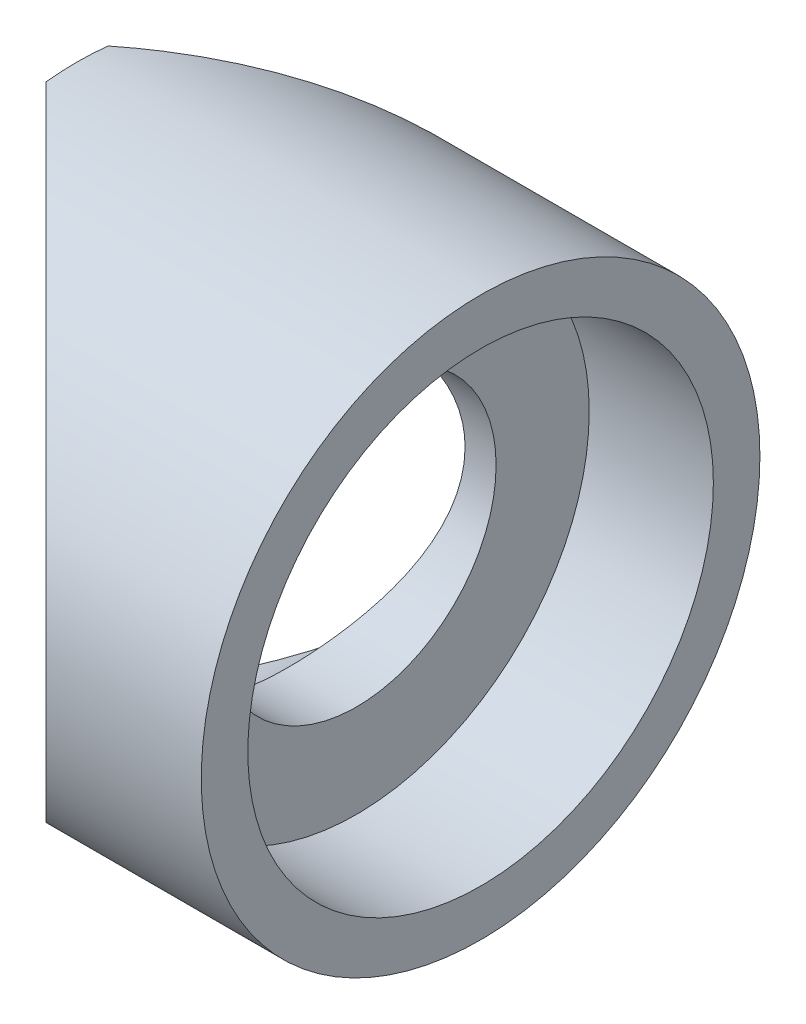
SolidWorks part; units mm, degrees
ref_plane "Front Plane" through (0, 0, 0) normal (0, 0, 1) x (1, 0, 0)
ref_plane "Top Plane" through (0, 0, 0) normal (0, 1, 0) x (1, 0, 0)
ref_plane "Right Plane" through (0, 0, 0) normal (1, 0, 0) x (0, 0, -1)
sketch "Sketch1" plane through (0, 0, 0) normal (1, 0, 0) x (0, 0, -1)
  circle A0 centre (0, 0) radius 28.575
  dimension "D1" = 57.15
extrude "Boss-Extrude1" add sketch "Sketch1" against normal blind 50.8
sketch "Sketch2" plane through (0, 0, 0) normal (1, 0, 0) x (0, 0, -1)
  circle A0 centre (0, 0) radius 14.2875
  dimension "D1" = 28.575
extrude "Cut-Extrude1" cut sketch "Sketch2" against normal through all
sketch "Sketch3" plane through (0, 0, 0) normal (1, 0, 0) x (0, 0, -1)
  circle A0 centre (0, 0) radius 23.8125
  dimension "D1" = 47.625
extrude "Cut-Extrude2" cut sketch "Sketch3" against normal blind 12.7
sketch "Sketch4" plane through (0, 0, 0) normal (0, 0, 1) x (1, 0, 0)
  circle A0 centre (-44.45, 0) radius 28.575
  point P2 (0, 0)
  dimension "D1" = 57.15
  dimension "D2" = 44.45
extrude "Cut-Extrude3" cut sketch "Sketch4" against normal mid plane 63.5 contours A0
sketch "Sketch5" plane through (0, 0, 0) normal (0, 0, 1) x (1, 0, 0)
  line L0 (0, -28.575) -> (0, 28.575) construction
  line L1 (-50.8, 28.575) -> (-41.275, 28.575)
  line L2 (-50.8, 28.575) -> (-50.8, -28.575)
  line L3 (-50.8, -28.575) -> (-41.275, -28.575)
  line L4 (-41.275, 28.575) -> (-41.275, -28.575)
  dimension "D1" = 41.275
  dimension "D2" = 57.15
extrude "Cut-Extrude6" cut sketch "Sketch5" against normal mid plane 63.5
